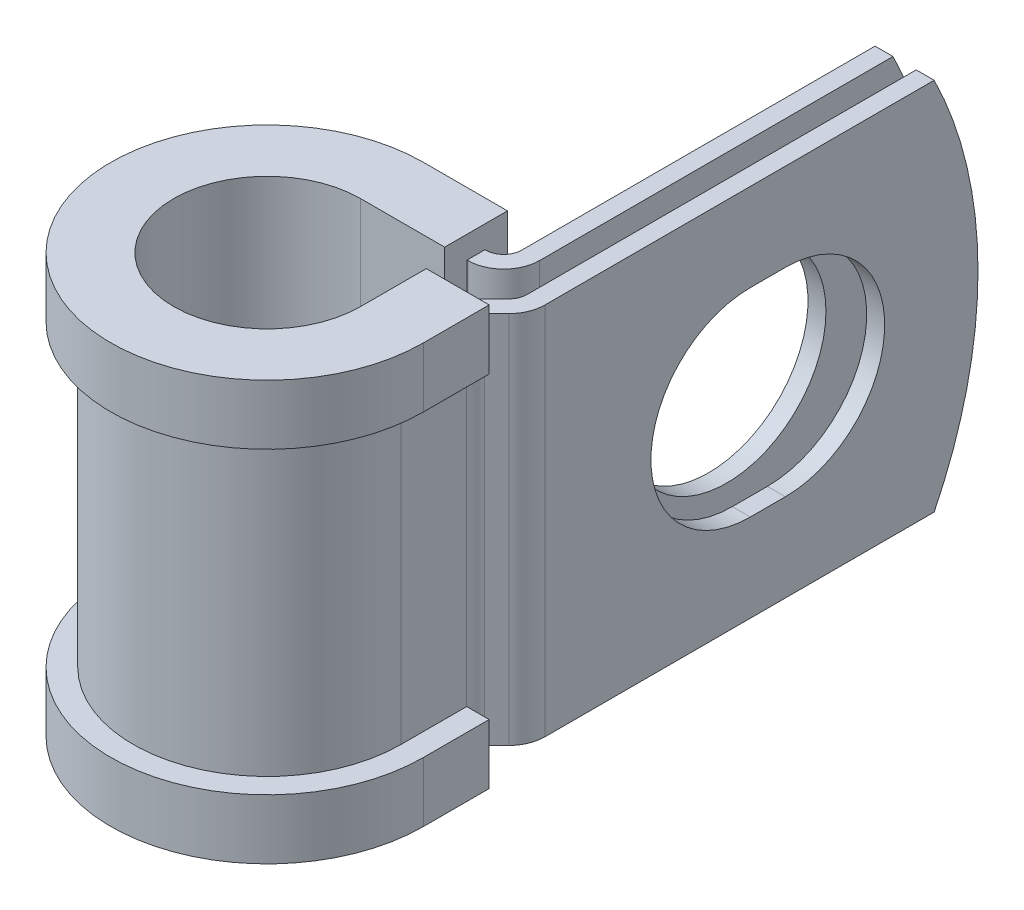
SolidWorks part; units mm, degrees
ref_plane "Front Plane" through (0, 0, 0) normal (0, 0, 1) x (1, 0, 0)
ref_plane "Top Plane" through (0, 0, 0) normal (0, 1, 0) x (1, 0, 0)
ref_plane "Right Plane" through (0, 0, 0) normal (1, 0, 0) x (0, 0, -1)
sketch "Sketch1" plane through (0, 0, 0) normal (0, 1, 0) x (1, 0, 0)
  line L0 (0, 7.874) -> (5.7583, 7.874)
  line L1 (7.874, 0) -> (7.874, 4.4615)
  line L2 (8.1967, 37.2872) -> (8.1967, 10.3124)
  line L3 (8.5882, 6.1857) -> (9.4144, 7.0119)
  line L5 (9.7715, 7.874) -> (9.7715, 37.2872)
  arc A0 (0, 7.874) -> (7.874, 0) centre (0, 0) ccw
  arc A1 (8.5882, 6.1857) -> (7.874, 4.4615) centre (10.3124, 4.4615) ccw
  arc A2 (9.4144, 7.0119) -> (9.7715, 7.874) centre (8.5523, 7.874) ccw
  arc A3 (5.7583, 7.874) -> (8.1967, 10.3124) centre (5.7583, 10.3124) ccw
extrude "Extrude-Thin1" add sketch "Sketch1" along normal mid plane 25.4 thin
sketch "Sketch2" plane through (6.9775, 0, 0) normal (-1, 0, 0) x (0, 0, 1)
  line L0 (-37.2872, 12.7) -> (-37.2872, -12.7) construction
  line L1 (0, 12.7) -> (0, -12.7) construction
  circle A0 centre (-23.0124, 0) radius 6.7437
  point P2 (-37.2872, 0)
extrude "Cut-Extrude1" cut sketch "Sketch2" against normal up to surface (1.2192 mm away)
sketch "Sketch3" plane through (10.9907, 0, 0) normal (1, 0, 0) x (0, 0, -1)
  line L0 (21.8186, 0) -> (24.2062, 0) construction
  line L1 (21.8186, 6.7437) -> (24.2062, 6.7437)
  line L2 (21.8186, -6.7437) -> (24.2062, -6.7437)
  line L3 (37.2872, 12.7) -> (37.2872, -12.7) construction
  arc A0 (21.8186, 6.7437) -> (21.8186, -6.7437) centre (21.8186, 0) ccw
  arc A1 (24.2062, -6.7437) -> (24.2062, 6.7437) centre (24.2062, 0) ccw
  point P3 (23.0124, 0)
  point P8 (37.2872, 0)
  point P11 (15.0749, 0)
  point P12 (30.9499, 0)
extrude "Cut-Extrude2" cut sketch "Sketch3" against normal up to surface (1.2192 mm away)
sketch "Sketch4" plane through (6.9775, 0, 0) normal (-1, 0, 0) x (0, 0, 1)
  line L0 (-37.2872, 12.7) -> (-37.2872, -12.7)
  line L1 (-37.2872, 12.7) -> (-34.3099, 12.7)
  line L2 (-37.2872, 12.7) -> (-10.3124, 12.7) construction
  line L3 (-37.2872, -12.7) -> (-34.3099, -12.7)
  line L4 (-37.2872, -12.7) -> (-10.3124, -12.7) construction
  arc A0 (-34.3099, 12.7) -> (-34.3099, -12.7) centre (-8.7122, 0) ccw
extrude "Cut-Extrude3" cut sketch "Sketch4" against normal through all contours A0 M4 M5 | A0 L0 M2
ref_plane "Plane1" through (0, 0, -4.4615) normal (0, 0, -1) x (-1, 0, 0)
ref_plane "Plane2" through (5.7075, 0, 0) normal (-1, 0, 0) x (0, 0, 1)
sketch "Sketch5" plane through (0, 0, -4.4615) normal (0, 0, -1) x (-1, 0, 0)
  line L0 (-9.0932, 12.7) -> (-7.874, 12.7)
  line L1 (-9.0932, 12.7) -> (-9.0932, -12.7) construction
  line L3 (-7.874, 12.7) -> (-7.874, -12.7)
  line L4 (-7.874, -12.7) -> (-9.0932, -12.7)
  line L5 (-9.0932, -12.7) -> (-9.0932, -10.16)
  line L6 (-9.0932, 12.7) -> (-9.0932, 10.16)
  line L7 (-10.6172, 14.224) -> (-10.6172, 10.16)
  line L8 (-10.6172, 14.224) -> (-6.35, 14.224)
  line L9 (-6.35, 14.224) -> (-6.35, -14.224)
  line L10 (-6.35, -14.224) -> (-10.6172, -14.224)
  line L11 (-10.6172, -14.224) -> (-10.6172, -10.16)
  line L12 (-10.6172, 10.16) -> (-9.0932, 10.16)
  line L13 (-9.0932, -10.16) -> (-10.6172, -10.16)
sketch "Sketch6" plane through (0, 12.7, 0) normal (0, 1, 0) x (1, 0, 0)
  line L0 (6.35, 0) -> (6.35, 4.4615)
  line L1 (6.35, 4.4615) -> (10.6172, 4.4615) construction
  line L2 (5.7075, 6.9878) -> (5.7075, -6.9878) construction
  line L5 (0, 6.35) -> (5.7075, 6.35)
  arc A0 (0, 6.35) -> (6.35, 0) centre (0, 0) ccw
sweep "Sweep1" add profiles "Sketch5" path "Sketch6"
equation "\"D4@Sketch5\" = \"D1@Extrude-Thin1\""
equation "\"D5@Sketch5\" = \"D5@Extrude-Thin1\""
equation "\"D1@Sketch3\" = \"D2@Sketch2\""
equation "\"D7@Sketch1\" = \"D3@Sketch2\" + \"D1@Sketch3\""
equation "\"D1@Sketch1\" = \"D1@Sketch6\" + 2 * \"D3@Sketch5\""
equation "\"D1@Sketch4\" = ( \"D1@Extrude-Thin1\" + .125 ) * 2"
equation "\"D9@Sketch1\"= \"D5@Extrude-Thin1\""
equation "\"D8@Sketch1\"= 2 * \"D5@Extrude-Thin1\""
equation "\"D2@Sketch1\" = 2 * \"D5@Extrude-Thin1\""
equation "\"D2@Sketch3\" = \"D1@Sketch2\""
